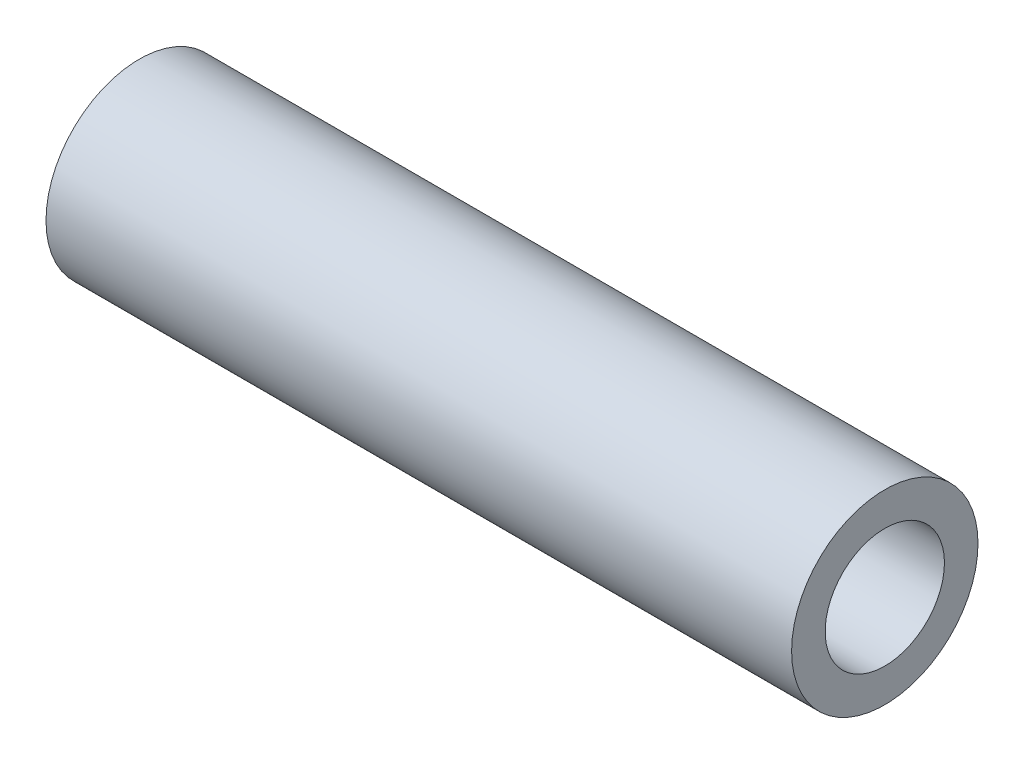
SolidWorks part; units mm, degrees
ref_plane "Plan de face" through (0, 0, 0) normal (0, 0, 1) x (1, 0, 0)
ref_plane "Plan de dessus" through (0, 0, 0) normal (0, 1, 0) x (1, 0, 0)
ref_plane "Plan de droite" through (0, 0, 0) normal (1, 0, 0) x (0, 0, -1)
sketch "Esquisse1" plane through (0, 0, 0) normal (1, 0, 0) x (0, 0, -1)
  circle A0 centre (0, 0) radius 25
  circle A1 centre (0, 0) radius 16
  dimension "D1" = 50
  dimension "D2" = 32
extrude "Boss.-Extru.1" add sketch "Esquisse1" along normal mid plane 200
